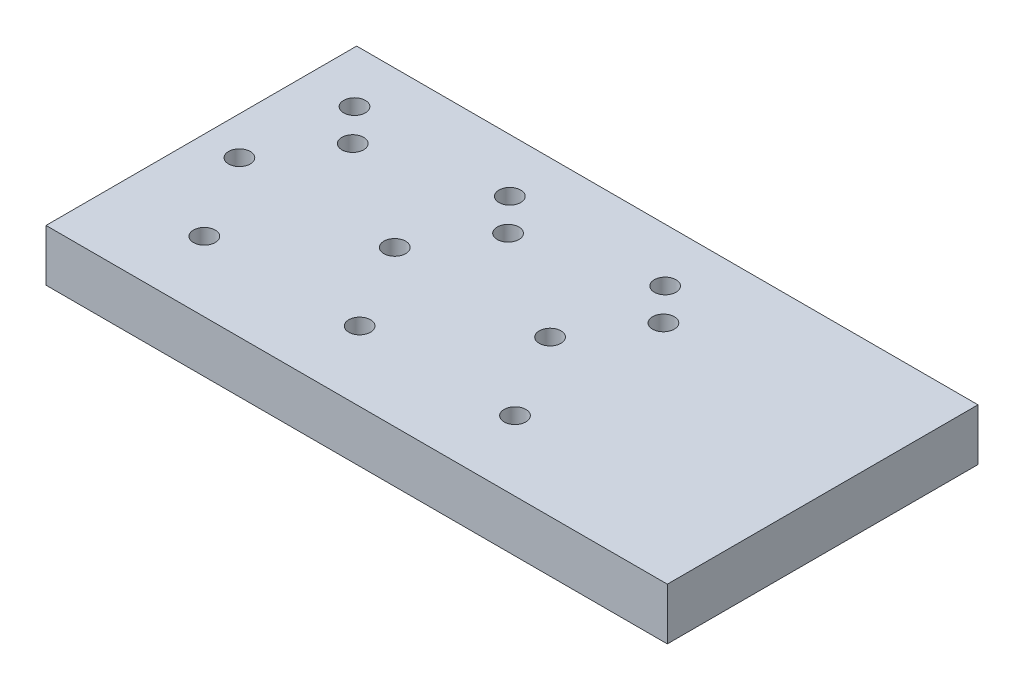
SolidWorks part; units mm, degrees
ref_plane "Vorderansicht" through (0, 0, 0) normal (0, 0, 1) x (1, 0, 0)
ref_plane "Draufsicht" through (0, 0, 0) normal (0, 1, 0) x (1, 0, 0)
ref_plane "Seitenansicht" through (0, 0, 0) normal (1, 0, 0) x (0, 0, -1)
sketch "Skizze1" plane through (0, 0, 0) normal (0, 1, 0) x (1, 0, 0)
  line L0 (-60, -30) -> (60, 30) construction
  line L1 (60, 30) -> (-60, 30)
  line L2 (60, 30) -> (60, -30)
  line L3 (60, -30) -> (-60, -30)
  line L4 (-60, 30) -> (-60, -30)
  dimension "D1" = 120
  dimension "D2" = 60
extrude "Linear austragen1" add sketch "Skizze1" along normal blind 10
hole_wizard "M5 Gewindebohrung1" positions "Skizze3" profile "Skizze2" tap size "M5" standard "DIN"
sketch "Skizze3" plane through (0, 10, 0) normal (0, 1, 0) x (-1, 0, 0)
  point P0 (42.8913, 16.5317)
  point P1 (52.646, 0)
  point P3 (44.0694, -13.3128)
  point P5 (50.0812, -19.6611)
sketch "Skizze2" plane through (-42.8913, 10, 16.5317) normal (1, 0, 0) x (0, 0, 1)
  line L0 (0, 0) -> (0, 15.2618)
  line L1 (0, 15.2618) -> (2.1, 14)
  line L2 (2.1, 14) -> (2.1, 0)
  line L5 (2.1, 0) -> (0, 0)
  line L10 (0, 15.2618) -> (-2.1, 14) construction
  line L11 (0, -6.35) -> (0, 107.95) construction
  dimension "Bohrerdurchmesser" = 4.2
  dimension "Bohrungstiefe" = 14
  dimension "Spitzenwinkel" = 118
pattern_linear "Lineares Muster1" count 3 spacing 30 along (1, 0, 0) of "M5 Gewindebohrung1"
